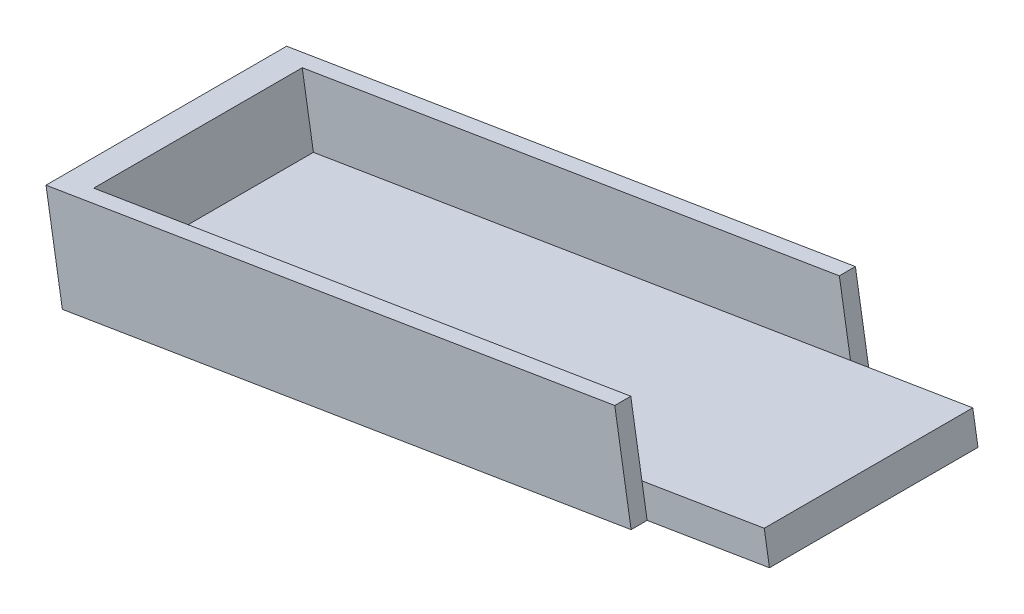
SolidWorks part; units mm, degrees
ref_plane "Front Plane" through (0, 0, 0) normal (0, 0, 1) x (1, 0, 0)
ref_plane "Top Plane" through (0, 0, 0) normal (0, 1, 0) x (1, 0, 0)
ref_plane "Right Plane" through (0, 0, 0) normal (1, 0, 0) x (0, 0, -1)
sketch "Sketch1" plane through (0, 0, 0) normal (0, 0, 1) x (1, 0, 0)
  line L0 (0, -38.4512) -> (-215.3798, -73.8791)
  line L1 (-215.3798, -73.8791) -> (-220.4748, -42.9046)
extrude "Extrude-Thin1" add sketch "Sketch1" along normal mid plane 65 thin
sketch "Sketch2" plane through (0, 0, -32.5) normal (0, 0, -1) x (-1, 0, 0)
  line L0 (220.4748, -42.9046) -> (215.3798, -73.8791)
  line L1 (220.4748, -42.9046) -> (43.2122, -13.7467)
  line L2 (215.3798, -73.8791) -> (38.1172, -44.7211)
  line L3 (43.2122, -13.7467) -> (38.1172, -44.7211)
extrude "Boss-Extrude1" add sketch "Sketch2" along normal blind 5
sketch "Sketch3" plane through (0, 0, 32.5) normal (0, 0, 1) x (1, 0, 0)
  line L0 (-220.4748, -42.9046) -> (-43.2122, -13.7467) construction
  line L1 (-43.2122, -13.7467) -> (-38.1172, -44.7211) construction
  line L2 (-38.1172, -44.7211) -> (-215.3798, -73.8791) construction
  line L3 (-215.3798, -73.8791) -> (-220.4748, -42.9046) construction
  line L4 (-220.4748, -42.9046) -> (-43.2122, -13.7467)
  line L5 (-43.2122, -13.7467) -> (-38.1172, -44.7211)
  line L6 (-38.1172, -44.7211) -> (-215.3798, -73.8791)
  line L7 (-215.3798, -73.8791) -> (-220.4748, -42.9046)
extrude "Boss-Extrude2" add sketch "Sketch3" along normal blind 5
